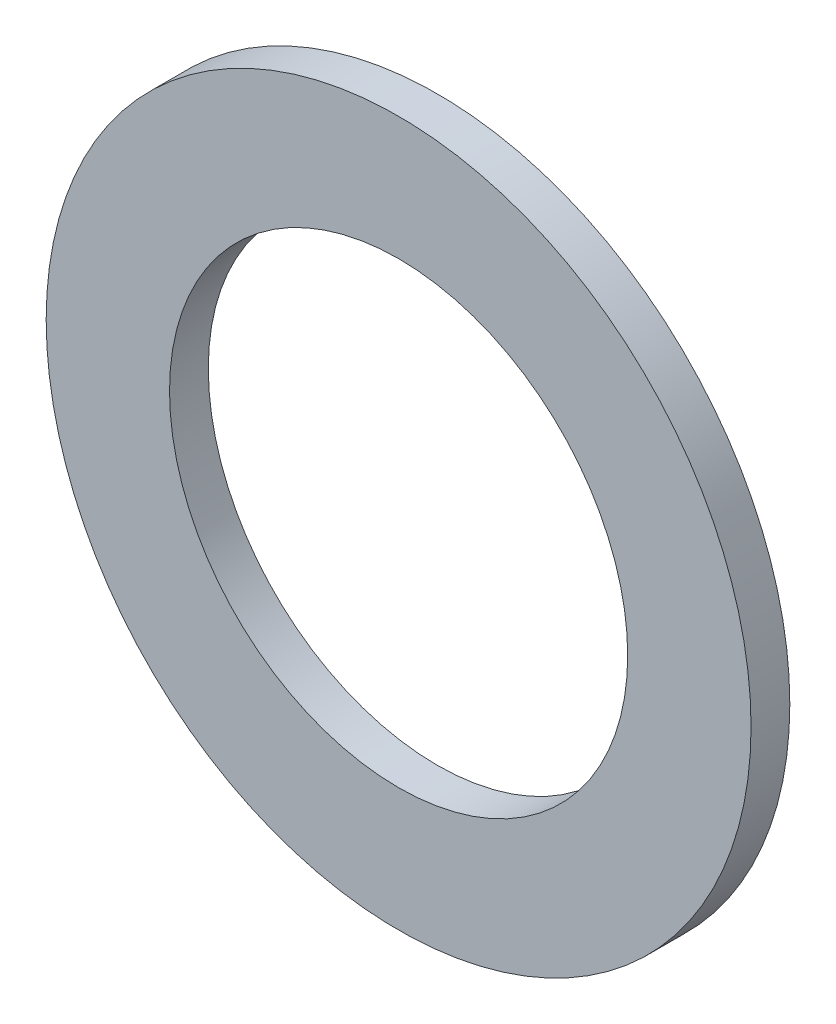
SolidWorks part; units mm, degrees
ref_plane "face" through (0, 0, 0) normal (0, 0, 1) x (1, 0, 0)
ref_plane "dessus" through (0, 0, 0) normal (0, 1, 0) x (1, 0, 0)
ref_plane "profil" through (0, 0, 0) normal (1, 0, 0) x (0, 0, -1)
sketch "Esquisse1" plane through (0, 0, 0) normal (0, 0, 1) x (1, 0, 0)
  circle A0 centre (0, 0) radius 6.5
  circle A1 centre (0, 0) radius 10
  dimension "D1" = 13
  dimension "D2" = 20
extrude "Base-Extrusion" add sketch "Esquisse1" along normal blind 1.1
